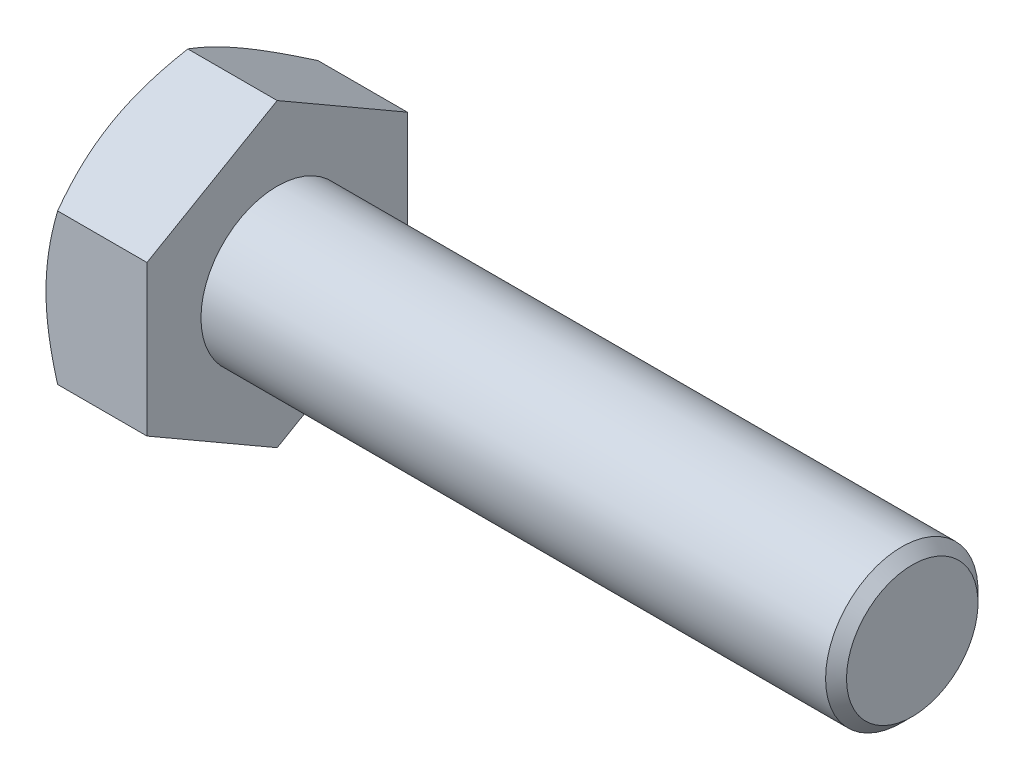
SolidWorks part; units mm, degrees
extrude "BaseHead" add sketch "Sketch1" along normal blind 15.9
sketch "Sketch1" plane through (0, 0, 0) normal (1, 0, 0) x (0, 0, -1)
  line L0 (20.5, 11.8357) -> (20.5, -11.8357)
  line L1 (-20.5, 11.8357) -> (-20.5, -11.8357)
  line L2 (20.5, -11.8357) -> (0, -23.6714)
  line L3 (0, -23.6714) -> (-20.5, -11.8357)
  line L4 (20.5, 11.8357) -> (0, 23.6714)
  line L5 (0, 23.6714) -> (-20.5, 11.8357)
ref_plane "Plane1" through (0, 0, 0) normal (0, 0, 1) x (1, 0, 0)
ref_plane "Plane2" through (0, 0, 0) normal (0, 1, 0) x (1, 0, 0)
ref_plane "Plane3" through (0, 0, 0) normal (1, 0, 0) x (0, 0, -1)
other "Configuration Table"
sketch "BodySke" plane through (0, 0, 0) normal (0, 0, 1) x (1, 0, 0)
  line L0 (0, 11.8357) -> (0, -11.8357) construction
  line L1 (0, 0) -> (115.9, 0)
  line L2 (0, 0) -> (0, 12)
  line L3 (0, 12) -> (114.252, 12)
  line L4 (115.9, 0) -> (115.9, 10.352)
  line L5 (15.9, 23.6714) -> (15.9, 11.8357) construction
  line L6 (115.9, 10.352) -> (114.252, 12)
  line L7 (0, 0) -> (96.52, 0) construction
  line L8 (115.9, -10.352) -> (114.252, -12) construction
  line L9 (0, -12) -> (114.252, -12) construction
  line L10 (18.9, 15.24) -> (18.9, -1.27) construction
  line L11 (15.9, 15.24) -> (15.9, -1.27) construction
  line L12 (15.9, 11.8357) -> (15.9, -11.8357) construction
revolve "BaseBody" add sketch "BodySke"
fillet "HeadFillet" [suppressed] radius 0.8
sketch "Sketch3" plane through (0, 0, 0) normal (0, 0, 1) x (1, 0, 0)
  line L0 (0, 20.5) -> (4.7177, 28.6714)
  line L1 (0, 23.6714) -> (0, 11.8357) construction
  line L2 (4.7177, 28.6714) -> (4.7177, 33.6714)
  line L3 (4.7177, 33.6714) -> (-10, 33.6714)
  line L4 (-10, 33.6714) -> (-10, 20.5)
  line L5 (-10, 20.5) -> (0, 20.5)
  line L6 (0, 0) -> (99.06, 0) construction
  line L7 (15.9, 23.6714) -> (0, 23.6714) construction
revolve "HeadChamfer" cut sketch "Sketch3" angle 360 about L6
sketch "ThdSchSke" plane through (0, 0, 0) normal (0, 0, 1) x (1, 0, 0)
  line L0 (18.9, -10.352) -> (17.7461, -12)
  line L1 (18.9, -10.352) -> (20.0539, -12)
  line L2 (20.0539, -12) -> (20.0539, -15)
  line L3 (-3.175, 0) -> (5.1513, 0) construction
  line L5 (20.0539, -15) -> (17.7461, -15)
  line L6 (17.7461, -15) -> (17.7461, -12)
revolve "ThreadSchematic" [suppressed] cut sketch "ThdSchSke" angle 360 about L3
pattern_linear "ThdSchPat" [suppressed]
equation "\"D3@Sketch1\" = \"Width_flats@Sketch1\" / 2"
equation "\"D4@Sketch1\" = \"D3@Sketch1\""
equation "\"D5@Sketch1\" = \"D4@Sketch1\""
equation "\"Thread_minor@ThreadCosmetic\" = \"Minor_dia@BodySke\""
equation "\"D1@Sketch3\" = \"Width_flats@Sketch1\" / 2"
equation "' \"D1@Sketch4\" = \"Width_flats@Sketch1\""
equation "\"Thread_length@ThreadCosmetic\" = ((sgn( (\"Length@BodySke\" - \"Advance@BodySke\" ) - \"Thread_nom@BodySke\" )-1)*( (\"Length@BodySke\" - \"Advance@BodySke\" ) - \"Thread_nom@BodySke\" ))/-2+ \"Thread_nom@BodySke\""
equation "\"Thread_minor@ThdSchSke\" = \"Minor_dia@BodySke\""
equation "\"Diameter@ThdSchSke\" = \"Diameter@BodySke\""
equation "\"Overcut@ThdSchSke\" = \"Diameter@BodySke\" * 1.25"
equation "\"Start@ThdSchSke\" = \"Head_ht@BaseHead\" + \"Length@BodySke\" - \"Thread_length@ThreadCosmetic\"  '---Non-countersunk---"
equation "\"Num_threads@ThdSchPat\" = int( \"Thread_length@ThreadCosmetic\" / \"Advance@BodySke\" + 0.999 )  + 1"
equation "\"Advance@ThdSchPat\" = \"Thread_length@ThreadCosmetic\" /  (\"Num_threads@ThdSchPat\" - 1) 'relax it"
equation "\"Num_threads@ThdSchPat\" = \"Num_threads@ThdSchPat\" - sgn( \"Num_threads@ThdSchPat\" - 1) '---chamfered tips only---"
